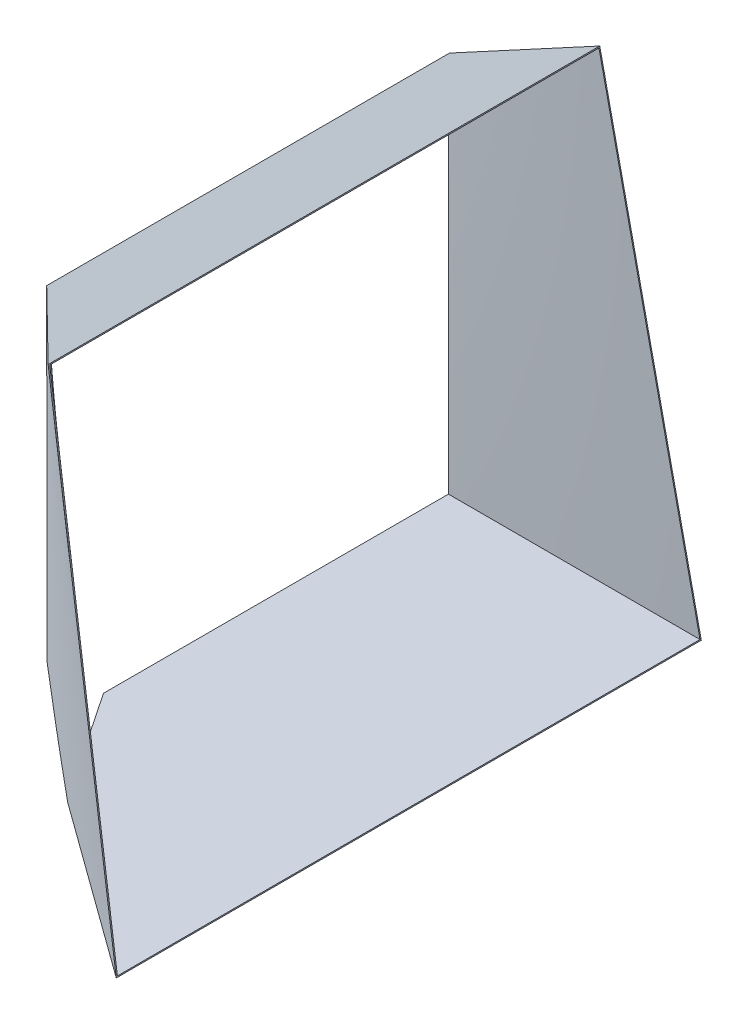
SolidWorks part; units mm, degrees
ref_plane "Ebene vorne" through (0, 0, 0) normal (0, 0, 1) x (1, 0, 0)
ref_plane "Ebene oben" through (0, 0, 0) normal (0, 1, 0) x (1, 0, 0)
ref_plane "Ebene rechts" through (0, 0, 0) normal (1, 0, 0) x (0, 0, -1)
sketch3d "3D-Skizze2"
  line L3 (880.8836, 197.3948, 234.6444) -> (1342.4505, 180.9851, 564.7744)
  line L10 (1182.2505, 1089.524, -509.7757) -> (1182.2505, 1089.524, 533.0645)
  line L11 (1342.4505, 180.9851, -541.4856) -> (1182.2505, 1089.524, -509.7757)
  line L15 (880.8836, 197.3948, 234.6444) -> (880.8836, 919.3948, 234.6444)
  line L17 (880.8836, 919.3948, -525.3556) -> (880.8836, 197.3948, -525.3556)
  line L18 (880.8836, 197.3948, -525.3556) -> (880.8836, 197.3948, 234.6444)
ref_plane "Ebene7" through (880.8836, 0, 0) normal (-1, 0, 0) x (0, 0, 1)
ref_plane "Ebene8" through (1332.9209, 235.0299, 0) normal (0.9848, 0.1736, 0) x (0, 0, -1)
sketch "Skizze8" plane through (880.8836, 0, 0) normal (-1, 0, 0) x (0, 0, 1)
  line L0 (-525.3556, 919.3948) -> (234.6444, 919.3948)
  line L2 (234.6444, 919.3948) -> (234.6444, 197.3948)
  line L3 (234.6444, 197.3948) -> (-525.3556, 197.3948)
  line L4 (-525.3556, 197.3948) -> (-525.3556, 919.3948)
sketch "Skizze9" plane through (1332.9209, 235.0299, 0) normal (0.9848, 0.1736, 0) x (0, 0, -1)
  line L0 (-533.0645, 867.676) -> (509.7757, 867.676)
  line L1 (509.7757, 867.676) -> (541.4856, -54.8786)
  line L2 (541.4856, -54.8786) -> (-564.7744, -54.8786)
  line L3 (-564.7744, -54.8786) -> (-533.0645, 867.676)
loft "Ausformung3" add profiles "Skizze9", "Skizze8"
ref_plane "Ebene9" through (880.8836, 197.3948, 234.6444) normal (0, 1, 0) x (-1, 0, 0)
sketch3d "3D-Skizze4"
  line L0 (880.8836, 197.3948, 234.6444) -> (880.8836, 197.3948, 129.6444)
  line L1 (880.8836, 197.3948, -525.3556) -> (880.8836, 197.3948, 234.6444) construction
  line L2 (880.8836, 197.3948, 234.6444) -> (880.8836, 302.3948, 234.6444)
  line L3 (880.8836, 197.3948, 234.6444) -> (880.8836, 919.3948, 234.6444) construction
  line L4 (880.8836, 197.3948, 234.6444) -> (1013.407, 192.6833, 329.4302)
  line L7 (880.8836, 197.3948, 234.6444) -> (1342.4505, 180.9851, 564.7744) construction
  line L8 (880.8836, 197.3948, 129.6444) -> (880.8836, 302.3948, 234.6444)
  line L9 (880.8836, 302.3948, 234.6444) -> (1013.407, 192.6833, 329.4302)
  line L10 (880.8836, 197.3948, 129.6444) -> (1013.407, 192.6833, 329.4302)
  dimension "D1" = 105
  dimension "D2" = 105
  dimension "D4" = 163
ref_plane "Ebene10" through (502.6232, 325.7225, -325.7225) normal (0.7372, 0.4778, -0.4778) x (-0.4009, -0.2598, -0.8785)
sketch "Skizze13" plane through (502.6232, 325.7225, -325.7225) normal (0.7372, 0.4778, -0.4778) x (-0.4009, -0.2598, -0.8785)
  line L1 (-852.3586, -221.9127) -> (-433.4952, -221.9127)
  line L2 (-852.3586, -221.9127) -> (-852.3586, -492.6901)
  line L3 (-852.3586, -492.6901) -> (-433.4952, -492.6901)
  line L4 (-433.4952, -221.9127) -> (-433.4952, -492.6901)
extrude "Schnitt-Linear austragen1" cut sketch "Skizze13" against normal blind 100
shell "Wandung2" thickness 2
sketch "Skizze24" plane through (-181.6885, 321.8431, 0) normal (-0.4916, 0.8708, 0) x (-0.8708, -0.4916, 0)
  line L0 (-1220.1957, -527.3583) -> (-1565.8449, -511.7052)
sketch "Skizze25" plane through (-181.6885, 321.8431, 0) normal (-0.4916, 0.8708, 0) x (-0.8708, -0.4916, 0)
  line L0 (-1565.8449, 535.7197) -> (-1220.1957, 237.4603)
  dimension "Dicke" = 2
